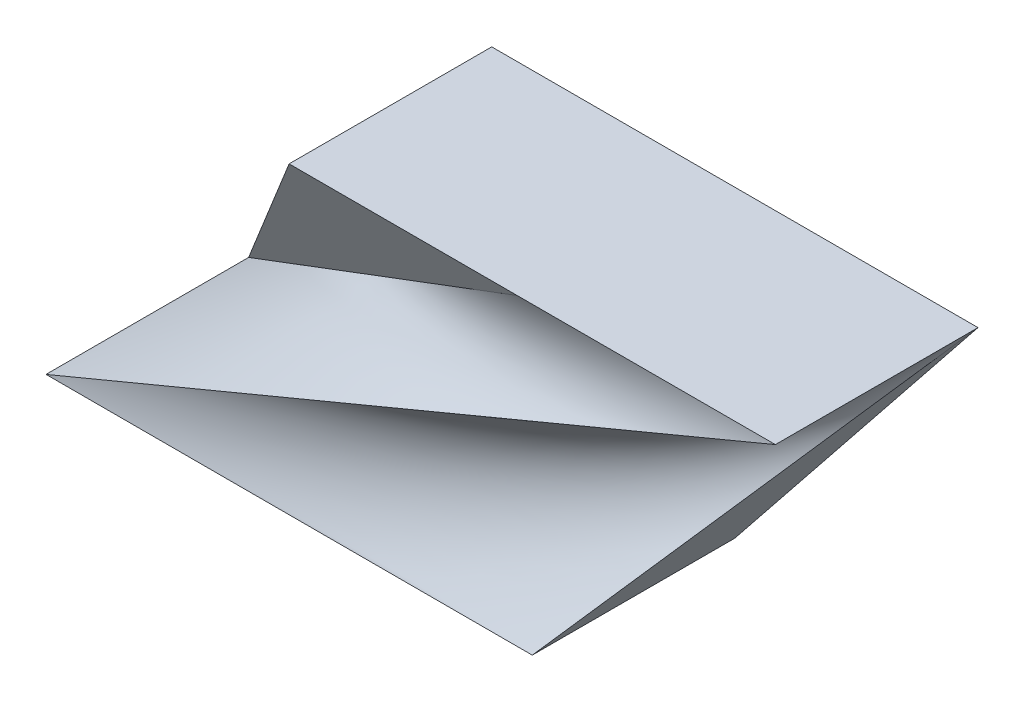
SolidWorks part; units mm, degrees
ref_plane "Front Plane" through (0, 0, 0) normal (0, 0, 1) x (1, 0, 0)
ref_plane "Top Plane" through (0, 0, 0) normal (0, 1, 0) x (1, 0, 0)
ref_plane "Right Plane" through (0, 0, 0) normal (1, 0, 0) x (0, 0, -1)
sketch "Sketch1" plane through (0, 0, 0) normal (0, 1, 0) x (1, 0, 0)
  line L1 (0, 0) -> (120, 0)
  line L2 (0, 0) -> (0, -50)
  line L3 (0, -50) -> (120, -50)
  line L4 (120, 0) -> (120, -50)
  dimension "D1" = 50
  dimension "D2" = 120
ref_plane "Plane1" through (0, 75, 0) normal (0, 1, 0) x (-1, 0, 0)
sketch "Sketch2" plane through (0, 75, 0) normal (0, 1, 0) x (-1, 0, 0)
  line L0 (0, 0) -> (-120, 0) construction
  line L1 (-60, 0) -> (-180, 0)
  line L2 (-60, 0) -> (-60, 50)
  line L3 (-60, 50) -> (-180, 50)
  line L4 (-180, 0) -> (-180, 50)
  line L5 (0, 50) -> (-120, 50) construction
  dimension "D1" = 120
loft "Loft1" add profiles "Sketch2", "Sketch1"
